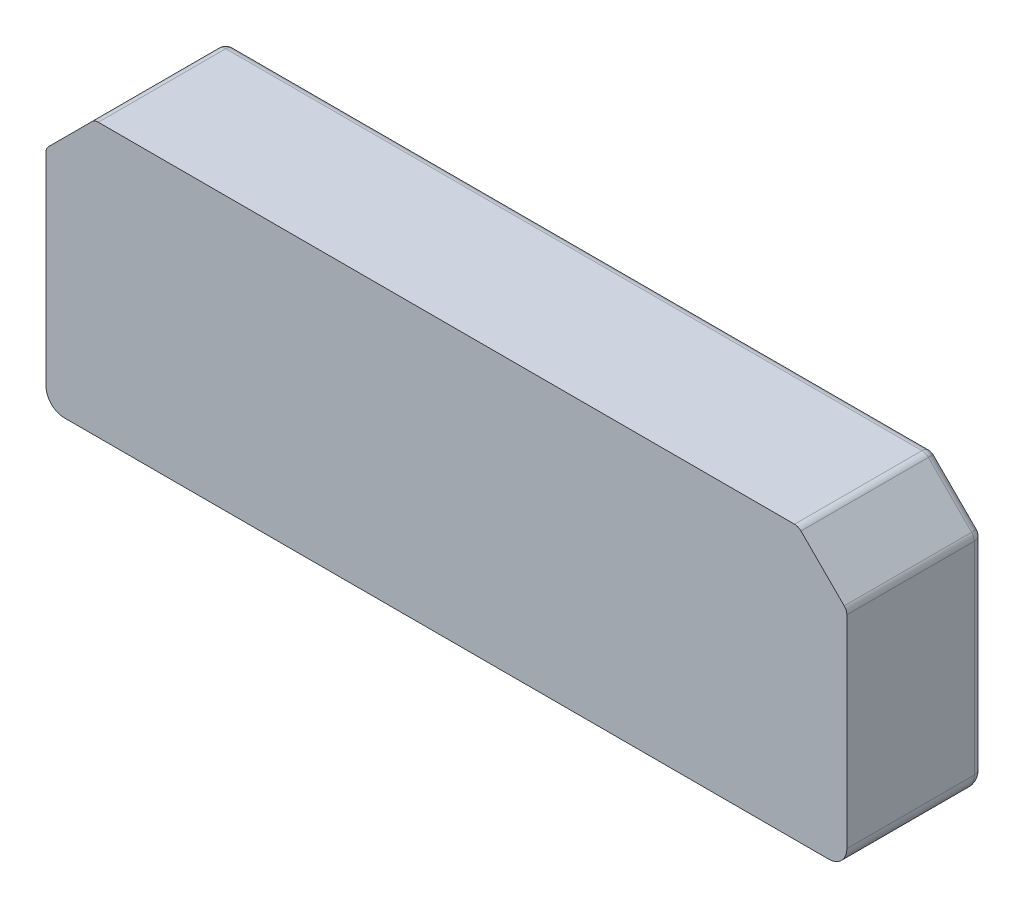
SolidWorks part; units mm, degrees
ref_plane "前视基准面" through (0, 0, 0) normal (0, 0, 1) x (1, 0, 0)
ref_plane "上视基准面" through (0, 0, 0) normal (0, 1, 0) x (1, 0, 0)
ref_plane "右视基准面" through (0, 0, 0) normal (1, 0, 0) x (0, 0, -1)
sketch "草图1" plane through (0, 0, 0) normal (0, 0, 1) x (1, 0, 0)
  line B0 (-126, 0) -> (126, 0)
  line B1 (132, 6) -> (132, 72.7574)
  line B2 (131.1213, 74.8787) -> (116.8787, 89.1213)
  line B3 (114.7574, 90) -> (-114.7574, 90)
  line B4 (-116.8787, 89.1213) -> (-131.1213, 74.8787)
  line B5 (-132, 72.7574) -> (-132, 6)
  arc B6 (126, 0) -> (132, 6) centre (126, 6) ccw
  arc B7 (132, 72.7574) -> (131.1213, 74.8787) centre (129, 72.7574) ccw
  arc B8 (116.8787, 89.1213) -> (114.7574, 90) centre (114.7574, 87) ccw
  arc B9 (-114.7574, 90) -> (-116.8787, 89.1213) centre (-114.7574, 87) ccw
  arc B10 (-131.1213, 74.8787) -> (-132, 72.7574) centre (-129, 72.7574) ccw
  arc B11 (-132, 6) -> (-126, 0) centre (-126, 6) ccw
sketch_block_instance "块1-1"
sketch_block "块1"
extrude "凸台-拉伸1" add sketch "草图1" along normal blind 45
fillet "圆角1" radius 3 12 edges at (0, 0, 0) (130.2426, 1.7574, 0) (132, 39.3787, 0) (131.7716, 73.9054, 0) (124, 82, 0) (115.9054, 89.7716, 0) (0, 90, 0) (-115.9054, 89.7716, 0) (-124, 82, 0) (-131.7716, 73.9054, 0) (-132, 39.3787, 0) (-130.2426, 1.7574, 0)
